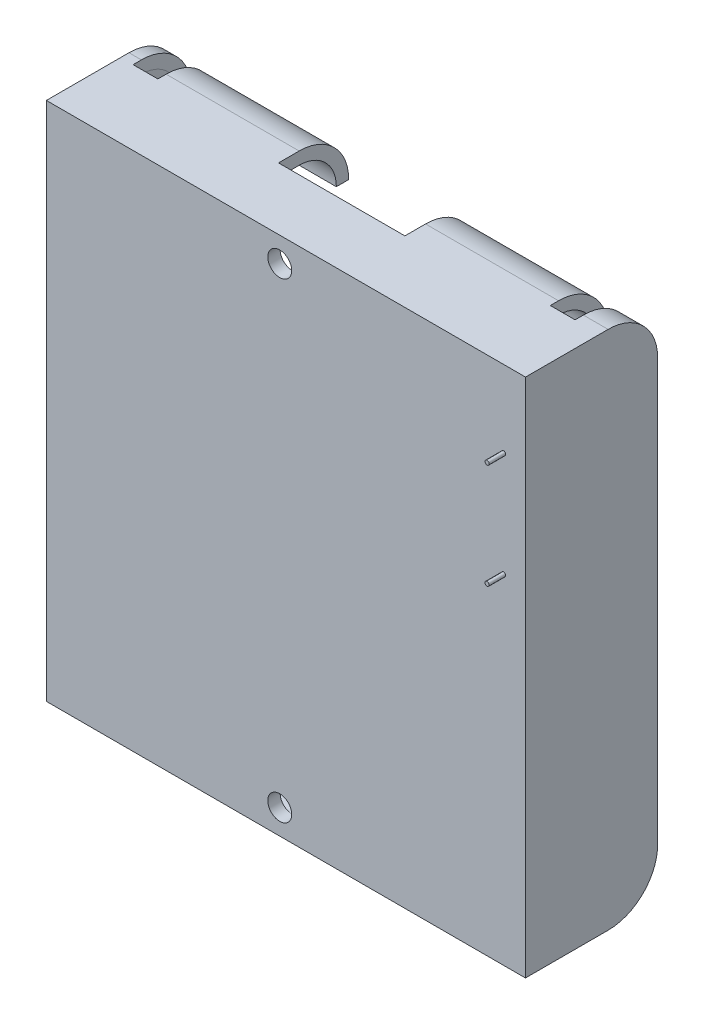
SolidWorks part; units mm, degrees
ref_plane "Face" through (0, 0, 0) normal (0, 0, 1) x (1, 0, 0)
ref_plane "Dessus" through (0, 0, 0) normal (0, 1, 0) x (1, 0, 0)
ref_plane "Droite" through (0, 0, 0) normal (1, 0, 0) x (0, 0, -1)
sketch "Esquisse1" plane through (0, 0, 0) normal (0, 0, 1) x (1, 0, 0)
  line L0 (-28.25, 36.4313) -> (-28.25, -47.0804) construction
  line L1 (29.7438, 23.4313) -> (29.7438, -60.0804) construction
  line L2 (-42.1775, -28.75) -> (43.8564, -28.75) construction
  line L5 (-28.25, 34.25) -> (29.75, 34.25)
  line L6 (-28.25, 34.25) -> (-28.2562, -28.75)
  line L7 (-28.2562, -28.75) -> (29.7438, -28.75)
  line L8 (29.75, 34.25) -> (29.7438, -28.75)
  dimension "D2" = 58
  dimension "D3" = 63
extrude "Base-Extrusion" add sketch "Esquisse1" against normal blind 16
fillet "Congé1" radius 6 2 edges at (0.75, 34.25, -16) (0.7438, -28.75, -16)
shell "Coque1" thickness 1.5
sketch "Esquisse3" plane through (0, 34.25, 0) normal (0, 1, 0) x (-1, 0, 0)
  line L0 (29.248, -9) -> (-31.6408, -9) construction
  line L1 (26.75, -2.27) -> (26.75, -22.4823) construction
  line L2 (-26.75, -2.27) -> (-26.75, -20.7193) construction
  line L3 (12.4989, -7.5) -> (-13.5693, -7.5) construction
  line L4 (0, -0.5699) -> (0, -21.8527) construction
  line L5 (23.75, -7.5) -> (23.75, -19.2081) construction
  line L6 (7.65, -19.2081) -> (7.65, -4.6628) construction
  line L7 (-7.65, -19.2081) -> (-7.65, -4.159) construction
  line L8 (-26.75, -19.2081) -> (-23.75, -19.2081)
  line L9 (26.75, -9) -> (23.75, -9)
  line L10 (26.75, -9) -> (26.75, -19.2081)
  line L11 (26.75, -19.2081) -> (23.75, -19.2081)
  line L12 (23.75, -9) -> (23.75, -19.2081)
  line L13 (7.65, -7.5) -> (-7.65, -7.5)
  line L14 (7.65, -7.5) -> (7.65, -18.3265)
  line L15 (7.65, -18.3265) -> (-7.65, -18.3265)
  line L16 (-7.65, -7.5) -> (-7.65, -18.3265)
  line L17 (-26.75, -9) -> (-26.75, -19.2081)
  line L18 (-26.75, -9) -> (-23.75, -9)
  line L19 (-23.75, -9) -> (-23.75, -19.2081)
extrude "Enlèv. mat.-Extru.2" cut sketch "Esquisse3" against normal through all
sketch "Esquisse5" plane through (-41.166, -21.1238, -1.5) normal (0, 0, -1) x (-1, 0, 0)
  line L0 (-69.4129, 23.8738) -> (0, 23.8738) construction
  line L3 (-41.166, 53.8738) -> (-41.166, 0) construction
  line L4 (-33.516, 53.8738) -> (-48.816, 53.8738) construction
  line L5 (-69.4104, -1.6262) -> (-69.4154, 49.3738) construction
  circle A0 centre (-41.166, 52.3738) radius 1.45
  circle A1 centre (-41.166, -4.6262) radius 1.45
  dimension "D1" = 2.9
  dimension "D2" = 57
extrude "Enlèv. mat.-Extru.4" cut sketch "Esquisse5" against normal through all
sketch "Esquisse6" plane through (0, 0, 0) normal (0, 0, 1) x (1, 0, 0)
  line L0 (34.8248, 34.25) -> (-33.4079, 34.25) construction
  line L1 (29.75, 37.0585) -> (29.75, -31.0974) construction
  line L2 (34.8248, 24.95) -> (-5.4386, 24.95) construction
  line L3 (34.8248, 12.25) -> (-5.4422, 12.25) construction
  line L4 (27.1, 37.0585) -> (27.1, 4.402) construction
  circle A0 centre (27.1, 24.95) radius 0.25
  circle A1 centre (27.1, 12.25) radius 0.25
  dimension "D1" = 9.3
  dimension "D2" = 12.7
  dimension "D3" = 2.65
extrude "Extrusion1" add sketch "Esquisse6" along normal blind 2
sketch "Esquisse7" plane through (0, 0, -1.5) normal (0, 0, -1) x (-1, 0, 0)
  line L0 (-42.657, 34.25) -> (36.4187, 34.25) construction
  line L1 (-42.657, 2.75) -> (37.5902, 2.75) construction
  line L2 (-42.657, 18.05) -> (37.5902, 18.05) construction
  line L3 (-42.657, -12.55) -> (37.5902, -12.55) construction
  line L4 (-31.3978, 18.55) -> (31.0651, 18.55) construction
  line L5 (-28.2484, -12.05) -> (26.7516, -12.05)
  line L6 (-28.2484, 18.55) -> (26.7516, 18.55)
  line L7 (-28.2484, 18.55) -> (-28.2484, 17.55)
  line L8 (-28.2484, 17.55) -> (26.7516, 17.55)
  line L9 (26.7516, 18.55) -> (26.7516, 17.55)
  line L10 (-28.2484, -13.05) -> (26.7516, -13.05)
  line L11 (26.7516, -13.05) -> (26.7516, -12.05)
  line L12 (-28.2484, -13.05) -> (-28.2484, -12.05)
  line L13 (-31.3978, 3.25) -> (31.0651, 3.25) construction
  line L15 (-28.2484, 3.25) -> (26.7532, 3.25)
  line L16 (-28.2484, 3.25) -> (-28.2484, 2.25)
  line L17 (-28.2484, 2.25) -> (26.7532, 2.25)
  line L18 (26.7532, 3.25) -> (26.7532, 2.25)
  dimension "D1" = 31.5
  dimension "D2" = 15.3
  dimension "D3" = 15.3
  dimension "D4" = 0.5
  dimension "D5" = 0.5
extrude "Extrusion2" add sketch "Esquisse7" along normal blind 14.5
sketch "Esquisse8" plane through (0, -13.05, 0) normal (0, -1, 0) x (1, 0, 0)
  line L0 (-33.3156, 0) -> (33.08, 0) construction
  line L1 (18.2444, -20.7011) -> (18.2444, 9.5377) construction
  line L3 (28.2444, -20.7011) -> (28.2444, 3.0801) construction
  line L4 (-33.3156, -7.5) -> (33.08, -7.5) construction
  line L5 (0.7444, 8.0055) -> (0.7444, -19.5743) construction
  line L6 (-33.3156, -16) -> (37.3223, -16) construction
  line L7 (18.2444, -7.5) -> (-16.7556, -7.5)
  line L8 (18.2444, -7.5) -> (28.2444, -16)
  line L9 (-26.7556, -16) -> (28.2444, -16)
  line L10 (29.7444, -20.7011) -> (29.7444, 8.0055) construction
  line L12 (-16.7556, -7.5) -> (-26.7556, -16)
  dimension "D1" = 7.5
  dimension "D2" = 10
  dimension "D3" = 29
extrude "Enlèv. mat.-Extru.5" cut sketch "Esquisse8" against normal blind 35
